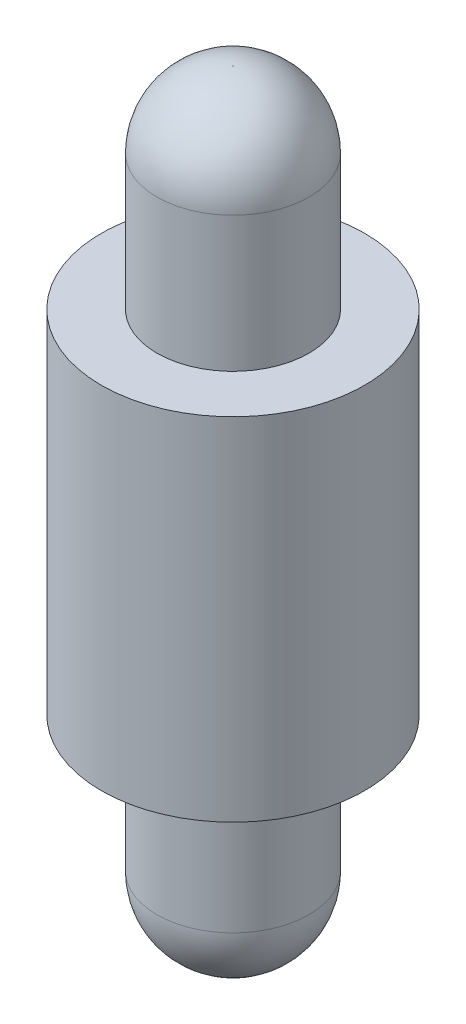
SolidWorks part; units mm, degrees
ref_plane "Plan de face" through (0, 0, 0) normal (0, 0, 1) x (1, 0, 0)
ref_plane "Plan de dessus" through (0, 0, 0) normal (0, 1, 0) x (1, 0, 0)
ref_plane "Plan de droite" through (0, 0, 0) normal (1, 0, 0) x (0, 0, -1)
sketch "Esquisse1" plane through (0, 0, 0) normal (0, 1, 0) x (1, 0, 0)
  circle A0 centre (0, 0) radius 2.25
extrude "Extrusion1" add sketch "Esquisse1" along normal blind 6
sketch "Esquisse2" plane through (0, 0, 0) normal (0, -1, 0) x (1, 0, 0)
  circle A0 centre (0, 0) radius 1.3
extrude "Extrusion2" add sketch "Esquisse2" along normal blind 3.6
sketch "Esquisse3" plane through (0, 6, 0) normal (0, 1, 0) x (-1, 0, 0)
  circle A0 centre (0, 0) radius 1.3
extrude "Extrusion3" add sketch "Esquisse3" along normal blind 3.6
fillet "Congé1" radius 1.29 2 edges at (0, -3.6, -1.3) (0, 9.6, 1.3)
